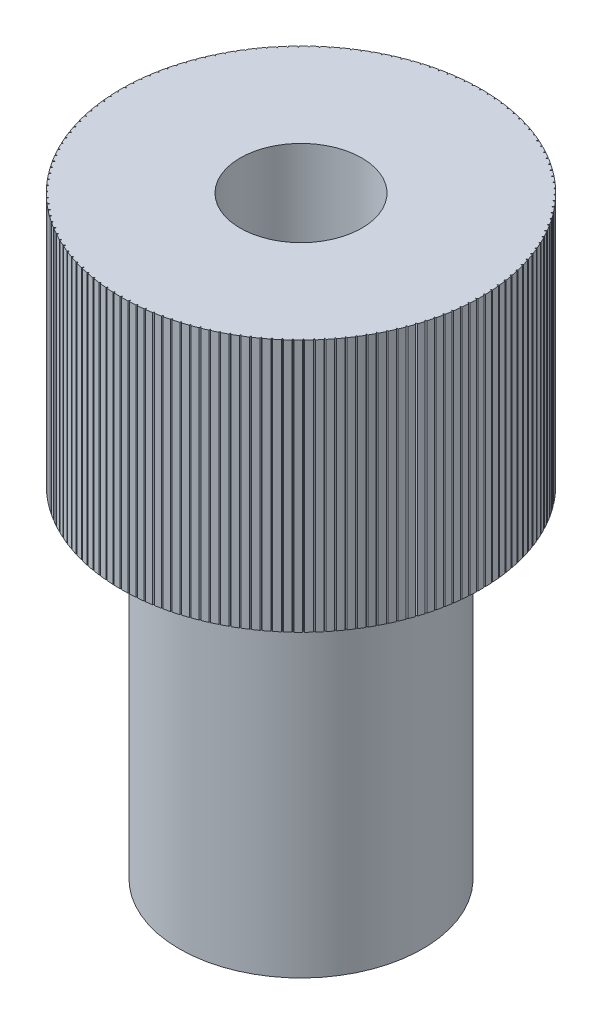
SolidWorks part; units mm, degrees
ref_plane "Front Plane" through (0, 0, 0) normal (0, 0, 1) x (1, 0, 0)
ref_plane "Top Plane" through (0, 0, 0) normal (0, 1, 0) x (1, 0, 0)
ref_plane "Right Plane" through (0, 0, 0) normal (1, 0, 0) x (0, 0, -1)
sketch "Sketch1" plane through (0, 0, 0) normal (1, 0, 0) x (0, 0, -1)
  line L0 (4.699, 8.89) -> (3.175, 8.89)
  line L1 (0, 0) -> (3.175, 0)
  line L2 (0, 0) -> (0, 15.494)
  line L3 (0, 15.494) -> (4.699, 15.494)
  line L4 (4.699, 8.89) -> (4.699, 15.494)
  line L5 (3.175, 8.89) -> (3.175, 0)
  line L6 (0, 0) -> (0, 37.8696) construction
  dimension "D1" = 4.699
  dimension "D2" = 3.175
  dimension "D3" = 8.89
  dimension "D4" = 15.494
revolve "Revolve1" add sketch "Sketch1" angle 360 about L6
sketch "Sketch2" plane through (0, 15.494, 0) normal (0, 1, 0) x (1, 0, 0)
  line L0 (0, 4.654) -> (0, 5.0784) construction
  line L1 (0.0182, 4.699) -> (0, 4.654)
  line L2 (-0.0182, 4.699) -> (0, 4.654)
  line L3 (0.2149, 4.6941) -> (0.1949, 4.6499)
  line L4 (0.1786, 4.6956) -> (0.1949, 4.6499)
  line L5 (0.4113, 4.681) -> (0.3894, 4.6377)
  line L6 (0.3751, 4.684) -> (0.3894, 4.6377)
  line L7 (0.607, 4.6596) -> (0.5833, 4.6173)
  line L8 (0.5709, 4.6642) -> (0.5833, 4.6173)
  line L9 (0.8016, 4.6301) -> (0.7761, 4.5888)
  line L10 (0.7657, 4.6362) -> (0.7761, 4.5888)
  line L11 (0.9947, 4.5925) -> (0.9676, 4.5523)
  line L12 (0.9592, 4.6001) -> (0.9676, 4.5523)
  line L13 (1.1862, 4.5468) -> (1.1574, 4.5078)
  line L14 (1.151, 4.5559) -> (1.1574, 4.5078)
  line L15 (1.3755, 4.4932) -> (1.3452, 4.4554)
  line L16 (1.3408, 4.5037) -> (1.3452, 4.4554)
  line L17 (1.5625, 4.4316) -> (1.5305, 4.3951)
  line L18 (1.5282, 4.4436) -> (1.5305, 4.3951)
  line L19 (1.7467, 4.3623) -> (1.7133, 4.3272)
  line L20 (1.7129, 4.3757) -> (1.7133, 4.3272)
  line L21 (1.9278, 4.2853) -> (1.893, 4.2517)
  line L22 (1.8946, 4.3001) -> (1.893, 4.2517)
  line L23 (2.1056, 4.2008) -> (2.0693, 4.1687)
  line L24 (2.073, 4.217) -> (2.0693, 4.1687)
  line L25 (2.2797, 4.109) -> (2.2421, 4.0783)
  line L26 (2.2478, 4.1265) -> (2.2421, 4.0783)
  line L27 (2.4497, 4.0099) -> (2.4109, 3.9809)
  line L28 (2.4186, 4.0287) -> (2.4109, 3.9809)
  line L29 (2.6155, 3.9038) -> (2.5755, 3.8764)
  line L30 (2.5852, 3.9239) -> (2.5755, 3.8764)
  line L31 (2.7767, 3.7909) -> (2.7356, 3.7652)
  line L32 (2.7473, 3.8122) -> (2.7356, 3.7652)
  line L33 (2.933, 3.6713) -> (2.8908, 3.6473)
  line L34 (2.9045, 3.6938) -> (2.8908, 3.6473)
  line L35 (3.0842, 3.5452) -> (3.041, 3.5231)
  line L36 (3.0566, 3.569) -> (3.041, 3.5231)
  line L37 (3.2299, 3.413) -> (3.1859, 3.3926)
  line L38 (3.2034, 3.4378) -> (3.1859, 3.3926)
  line L39 (3.37, 3.2747) -> (3.3252, 3.2562)
  line L40 (3.3446, 3.3007) -> (3.3252, 3.2562)
  line L41 (3.5042, 3.1307) -> (3.4586, 3.1141)
  line L42 (3.4799, 3.1577) -> (3.4586, 3.1141)
  line L43 (3.6322, 2.9812) -> (3.586, 2.9666)
  line L44 (3.609, 3.0092) -> (3.586, 2.9666)
  line L45 (3.7539, 2.8265) -> (3.7071, 2.8138)
  line L46 (3.7319, 2.8555) -> (3.7071, 2.8138)
  line L47 (3.8689, 2.6668) -> (3.8216, 2.6561)
  line L48 (3.8482, 2.6967) -> (3.8216, 2.6561)
  line L49 (3.9772, 2.5025) -> (3.9295, 2.4937)
  line L50 (3.9577, 2.5332) -> (3.9295, 2.4937)
  line L51 (4.0785, 2.3337) -> (4.0305, 2.327)
  line L52 (4.0603, 2.3652) -> (4.0305, 2.327)
  line L53 (4.1727, 2.1609) -> (4.1244, 2.1562)
  line L54 (4.1558, 2.1931) -> (4.1244, 2.1562)
  line L55 (4.2595, 1.9843) -> (4.2111, 1.9816)
  line L56 (4.244, 2.0172) -> (4.2111, 1.9816)
  line L57 (4.3388, 1.8042) -> (4.2904, 1.8035)
  line L58 (4.3248, 1.8377) -> (4.2904, 1.8035)
  line L59 (4.4106, 1.6209) -> (4.3621, 1.6223)
  line L60 (4.3979, 1.655) -> (4.3621, 1.6223)
  line L61 (4.4746, 1.4348) -> (4.4262, 1.4382)
  line L62 (4.4634, 1.4693) -> (4.4262, 1.4382)
  line L63 (4.5308, 1.2461) -> (4.4826, 1.2516)
  line L64 (4.521, 1.2811) -> (4.4826, 1.2516)
  line L65 (4.579, 1.0553) -> (4.531, 1.0627)
  line L66 (4.5707, 1.0907) -> (4.531, 1.0627)
  line L67 (4.6191, 0.8626) -> (4.5716, 0.8721)
  line L68 (4.6123, 0.8983) -> (4.5716, 0.8721)
  line L69 (4.6512, 0.6685) -> (4.6041, 0.6799)
  line L70 (4.6459, 0.7044) -> (4.6041, 0.6799)
  line L71 (4.6751, 0.4731) -> (4.6285, 0.4865)
  line L72 (4.6713, 0.5092) -> (4.6285, 0.4865)
  line L73 (4.6908, 0.2769) -> (4.6448, 0.2922)
  line L74 (4.6886, 0.3132) -> (4.6448, 0.2922)
  line L75 (4.6983, 0.0802) -> (4.653, 0.0975)
  line L76 (4.6976, 0.1166) -> (4.653, 0.0975)
  line L77 (4.6976, -0.1166) -> (4.653, -0.0975)
  line L78 (4.6983, -0.0802) -> (4.653, -0.0975)
  line L79 (4.6886, -0.3132) -> (4.6448, -0.2922)
  line L80 (4.6908, -0.2769) -> (4.6448, -0.2922)
  line L81 (4.6713, -0.5092) -> (4.6285, -0.4865)
  line L82 (4.6751, -0.4731) -> (4.6285, -0.4865)
  line L83 (4.6459, -0.7044) -> (4.6041, -0.6799)
  line L84 (4.6512, -0.6685) -> (4.6041, -0.6799)
  line L85 (4.6123, -0.8983) -> (4.5716, -0.8721)
  line L86 (4.6191, -0.8626) -> (4.5716, -0.8721)
  line L87 (4.5707, -1.0907) -> (4.531, -1.0627)
  line L88 (4.579, -1.0553) -> (4.531, -1.0627)
  line L89 (4.521, -1.2811) -> (4.4826, -1.2516)
  line L90 (4.5308, -1.2461) -> (4.4826, -1.2516)
  line L91 (4.4634, -1.4693) -> (4.4262, -1.4382)
  line L92 (4.4746, -1.4348) -> (4.4262, -1.4382)
  line L93 (4.3979, -1.655) -> (4.3621, -1.6223)
  line L94 (4.4106, -1.6209) -> (4.3621, -1.6223)
  line L95 (4.3248, -1.8377) -> (4.2904, -1.8035)
  line L96 (4.3388, -1.8042) -> (4.2904, -1.8035)
  line L97 (4.244, -2.0172) -> (4.2111, -1.9816)
  line L98 (4.2595, -1.9843) -> (4.2111, -1.9816)
  line L99 (4.1558, -2.1931) -> (4.1244, -2.1562)
  line L100 (4.1727, -2.1609) -> (4.1244, -2.1562)
  line L101 (4.0603, -2.3652) -> (4.0305, -2.327)
  line L102 (4.0785, -2.3337) -> (4.0305, -2.327)
  line L103 (3.9577, -2.5332) -> (3.9295, -2.4937)
  line L104 (3.9772, -2.5025) -> (3.9295, -2.4937)
  line L105 (3.8482, -2.6967) -> (3.8216, -2.6561)
  line L106 (3.8689, -2.6668) -> (3.8216, -2.6561)
  line L107 (3.7319, -2.8555) -> (3.7071, -2.8138)
  line L108 (3.7539, -2.8265) -> (3.7071, -2.8138)
  line L109 (3.609, -3.0092) -> (3.586, -2.9666)
  line L110 (3.6322, -2.9812) -> (3.586, -2.9666)
  line L111 (3.4799, -3.1577) -> (3.4586, -3.1141)
  line L112 (3.5042, -3.1307) -> (3.4586, -3.1141)
  line L113 (3.3446, -3.3007) -> (3.3252, -3.2562)
  line L114 (3.37, -3.2747) -> (3.3252, -3.2562)
  line L115 (3.2034, -3.4378) -> (3.1859, -3.3926)
  line L116 (3.2299, -3.413) -> (3.1859, -3.3926)
  line L117 (3.0566, -3.569) -> (3.041, -3.5231)
  line L118 (3.0842, -3.5452) -> (3.041, -3.5231)
  line L119 (2.9045, -3.6938) -> (2.8908, -3.6473)
  line L120 (2.933, -3.6713) -> (2.8908, -3.6473)
  line L121 (2.7473, -3.8122) -> (2.7356, -3.7652)
  line L122 (2.7767, -3.7909) -> (2.7356, -3.7652)
  line L123 (2.5852, -3.9239) -> (2.5755, -3.8764)
  line L124 (2.6155, -3.9038) -> (2.5755, -3.8764)
  line L125 (2.4186, -4.0287) -> (2.4109, -3.9809)
  line L126 (2.4497, -4.0099) -> (2.4109, -3.9809)
  line L127 (2.2478, -4.1265) -> (2.2421, -4.0783)
  line L128 (2.2797, -4.109) -> (2.2421, -4.0783)
  line L129 (2.073, -4.217) -> (2.0693, -4.1687)
  line L130 (2.1056, -4.2008) -> (2.0693, -4.1687)
  line L131 (1.8946, -4.3001) -> (1.893, -4.2517)
  line L132 (1.9278, -4.2853) -> (1.893, -4.2517)
  line L133 (1.7129, -4.3757) -> (1.7133, -4.3272)
  line L134 (1.7467, -4.3623) -> (1.7133, -4.3272)
  line L135 (1.5282, -4.4436) -> (1.5305, -4.3951)
  line L136 (1.5625, -4.4316) -> (1.5305, -4.3951)
  line L137 (1.3408, -4.5037) -> (1.3452, -4.4554)
  line L138 (1.3755, -4.4932) -> (1.3452, -4.4554)
  line L139 (1.151, -4.5559) -> (1.1574, -4.5078)
  line L140 (1.1862, -4.5468) -> (1.1574, -4.5078)
  line L141 (0.9592, -4.6001) -> (0.9676, -4.5523)
  line L142 (0.9947, -4.5925) -> (0.9676, -4.5523)
  line L143 (0.7657, -4.6362) -> (0.7761, -4.5888)
  line L144 (0.8016, -4.6301) -> (0.7761, -4.5888)
  line L145 (0.5709, -4.6642) -> (0.5833, -4.6173)
  line L146 (0.607, -4.6596) -> (0.5833, -4.6173)
  line L147 (0.3751, -4.684) -> (0.3894, -4.6377)
  line L148 (0.4113, -4.681) -> (0.3894, -4.6377)
  line L149 (0.1786, -4.6956) -> (0.1949, -4.6499)
  line L150 (0.2149, -4.6941) -> (0.1949, -4.6499)
  line L151 (-0.0182, -4.699) -> (0, -4.654)
  line L152 (0.0182, -4.699) -> (0, -4.654)
  line L153 (-0.2149, -4.6941) -> (-0.1949, -4.6499)
  line L154 (-0.1786, -4.6956) -> (-0.1949, -4.6499)
  line L155 (-0.4113, -4.681) -> (-0.3894, -4.6377)
  line L156 (-0.3751, -4.684) -> (-0.3894, -4.6377)
  line L157 (-0.607, -4.6596) -> (-0.5833, -4.6173)
  line L158 (-0.5709, -4.6642) -> (-0.5833, -4.6173)
  line L159 (-0.8016, -4.6301) -> (-0.7761, -4.5888)
  line L160 (-0.7657, -4.6362) -> (-0.7761, -4.5888)
  line L161 (-0.9947, -4.5925) -> (-0.9676, -4.5523)
  line L162 (-0.9592, -4.6001) -> (-0.9676, -4.5523)
  line L163 (-1.1862, -4.5468) -> (-1.1574, -4.5078)
  line L164 (-1.151, -4.5559) -> (-1.1574, -4.5078)
  line L165 (-1.3755, -4.4932) -> (-1.3452, -4.4554)
  line L166 (-1.3408, -4.5037) -> (-1.3452, -4.4554)
  line L167 (-1.5625, -4.4316) -> (-1.5305, -4.3951)
  line L168 (-1.5282, -4.4436) -> (-1.5305, -4.3951)
  line L169 (-1.7467, -4.3623) -> (-1.7133, -4.3272)
  line L170 (-1.7129, -4.3757) -> (-1.7133, -4.3272)
  line L171 (-1.9278, -4.2853) -> (-1.893, -4.2517)
  line L172 (-1.8946, -4.3001) -> (-1.893, -4.2517)
  line L173 (-2.1056, -4.2008) -> (-2.0693, -4.1687)
  line L174 (-2.073, -4.217) -> (-2.0693, -4.1687)
  line L175 (-2.2797, -4.109) -> (-2.2421, -4.0783)
  line L176 (-2.2478, -4.1265) -> (-2.2421, -4.0783)
  line L177 (-2.4497, -4.0099) -> (-2.4109, -3.9809)
  line L178 (-2.4186, -4.0287) -> (-2.4109, -3.9809)
  line L179 (-2.6155, -3.9038) -> (-2.5755, -3.8764)
  line L180 (-2.5852, -3.9239) -> (-2.5755, -3.8764)
  line L181 (-2.7767, -3.7909) -> (-2.7356, -3.7652)
  line L182 (-2.7473, -3.8122) -> (-2.7356, -3.7652)
  line L183 (-2.933, -3.6713) -> (-2.8908, -3.6473)
  line L184 (-2.9045, -3.6938) -> (-2.8908, -3.6473)
  line L185 (-3.0842, -3.5452) -> (-3.041, -3.5231)
  line L186 (-3.0566, -3.569) -> (-3.041, -3.5231)
  line L187 (-3.2299, -3.413) -> (-3.1859, -3.3926)
  line L188 (-3.2034, -3.4378) -> (-3.1859, -3.3926)
  line L189 (-3.37, -3.2747) -> (-3.3252, -3.2562)
  line L190 (-3.3446, -3.3007) -> (-3.3252, -3.2562)
  line L191 (-3.5042, -3.1307) -> (-3.4586, -3.1141)
  line L192 (-3.4799, -3.1577) -> (-3.4586, -3.1141)
  line L193 (-3.6322, -2.9812) -> (-3.586, -2.9666)
  line L194 (-3.609, -3.0092) -> (-3.586, -2.9666)
  line L195 (-3.7539, -2.8265) -> (-3.7071, -2.8138)
  line L196 (-3.7319, -2.8555) -> (-3.7071, -2.8138)
  line L197 (-3.8689, -2.6668) -> (-3.8216, -2.6561)
  line L198 (-3.8482, -2.6967) -> (-3.8216, -2.6561)
  line L199 (-3.9772, -2.5025) -> (-3.9295, -2.4937)
  line L200 (-3.9577, -2.5332) -> (-3.9295, -2.4937)
  line L201 (-4.0785, -2.3337) -> (-4.0305, -2.327)
  line L202 (-4.0603, -2.3652) -> (-4.0305, -2.327)
  line L203 (-4.1727, -2.1609) -> (-4.1244, -2.1562)
  line L204 (-4.1558, -2.1931) -> (-4.1244, -2.1562)
  line L205 (-4.2595, -1.9843) -> (-4.2111, -1.9816)
  line L206 (-4.244, -2.0172) -> (-4.2111, -1.9816)
  line L207 (-4.3388, -1.8042) -> (-4.2904, -1.8035)
  line L208 (-4.3248, -1.8377) -> (-4.2904, -1.8035)
  line L209 (-4.4106, -1.6209) -> (-4.3621, -1.6223)
  line L210 (-4.3979, -1.655) -> (-4.3621, -1.6223)
  line L211 (-4.4746, -1.4348) -> (-4.4262, -1.4382)
  line L212 (-4.4634, -1.4693) -> (-4.4262, -1.4382)
  line L213 (-4.5308, -1.2461) -> (-4.4826, -1.2516)
  line L214 (-4.521, -1.2811) -> (-4.4826, -1.2516)
  line L215 (-4.579, -1.0553) -> (-4.531, -1.0627)
  line L216 (-4.5707, -1.0907) -> (-4.531, -1.0627)
  line L217 (-4.6191, -0.8626) -> (-4.5716, -0.8721)
  line L218 (-4.6123, -0.8983) -> (-4.5716, -0.8721)
  line L219 (-4.6512, -0.6685) -> (-4.6041, -0.6799)
  line L220 (-4.6459, -0.7044) -> (-4.6041, -0.6799)
  line L221 (-4.6751, -0.4731) -> (-4.6285, -0.4865)
  line L222 (-4.6713, -0.5092) -> (-4.6285, -0.4865)
  line L223 (-4.6908, -0.2769) -> (-4.6448, -0.2922)
  line L224 (-4.6886, -0.3132) -> (-4.6448, -0.2922)
  line L225 (-4.6983, -0.0802) -> (-4.653, -0.0975)
  line L226 (-4.6976, -0.1166) -> (-4.653, -0.0975)
  line L227 (-4.6976, 0.1166) -> (-4.653, 0.0975)
  line L228 (-4.6983, 0.0802) -> (-4.653, 0.0975)
  line L229 (-4.6886, 0.3132) -> (-4.6448, 0.2922)
  line L230 (-4.6908, 0.2769) -> (-4.6448, 0.2922)
  line L231 (-4.6713, 0.5092) -> (-4.6285, 0.4865)
  line L232 (-4.6751, 0.4731) -> (-4.6285, 0.4865)
  line L233 (-4.6459, 0.7044) -> (-4.6041, 0.6799)
  line L234 (-4.6512, 0.6685) -> (-4.6041, 0.6799)
  line L235 (-4.6123, 0.8983) -> (-4.5716, 0.8721)
  line L236 (-4.6191, 0.8626) -> (-4.5716, 0.8721)
  line L237 (-4.5707, 1.0907) -> (-4.531, 1.0627)
  line L238 (-4.579, 1.0553) -> (-4.531, 1.0627)
  line L239 (-4.521, 1.2811) -> (-4.4826, 1.2516)
  line L240 (-4.5308, 1.2461) -> (-4.4826, 1.2516)
  line L241 (-4.4634, 1.4693) -> (-4.4262, 1.4382)
  line L242 (-4.4746, 1.4348) -> (-4.4262, 1.4382)
  line L243 (-4.3979, 1.655) -> (-4.3621, 1.6223)
  line L244 (-4.4106, 1.6209) -> (-4.3621, 1.6223)
  line L245 (-4.3248, 1.8377) -> (-4.2904, 1.8035)
  line L246 (-4.3388, 1.8042) -> (-4.2904, 1.8035)
  line L247 (-4.244, 2.0172) -> (-4.2111, 1.9816)
  line L248 (-4.2595, 1.9843) -> (-4.2111, 1.9816)
  line L249 (-4.1558, 2.1931) -> (-4.1244, 2.1562)
  line L250 (-4.1727, 2.1609) -> (-4.1244, 2.1562)
  line L251 (-4.0603, 2.3652) -> (-4.0305, 2.327)
  line L252 (-4.0785, 2.3337) -> (-4.0305, 2.327)
  line L253 (-3.9577, 2.5332) -> (-3.9295, 2.4937)
  line L254 (-3.9772, 2.5025) -> (-3.9295, 2.4937)
  line L255 (-3.8482, 2.6967) -> (-3.8216, 2.6561)
  line L256 (-3.8689, 2.6668) -> (-3.8216, 2.6561)
  line L257 (-3.7319, 2.8555) -> (-3.7071, 2.8138)
  line L258 (-3.7539, 2.8265) -> (-3.7071, 2.8138)
  line L259 (-3.609, 3.0092) -> (-3.586, 2.9666)
  line L260 (-3.6322, 2.9812) -> (-3.586, 2.9666)
  line L261 (-3.4799, 3.1577) -> (-3.4586, 3.1141)
  line L262 (-3.5042, 3.1307) -> (-3.4586, 3.1141)
  line L263 (-3.3446, 3.3007) -> (-3.3252, 3.2562)
  line L264 (-3.37, 3.2747) -> (-3.3252, 3.2562)
  line L265 (-3.2034, 3.4378) -> (-3.1859, 3.3926)
  line L266 (-3.2299, 3.413) -> (-3.1859, 3.3926)
  line L267 (-3.0566, 3.569) -> (-3.041, 3.5231)
  line L268 (-3.0842, 3.5452) -> (-3.041, 3.5231)
  line L269 (-2.9045, 3.6938) -> (-2.8908, 3.6473)
  line L270 (-2.933, 3.6713) -> (-2.8908, 3.6473)
  line L271 (-2.7473, 3.8122) -> (-2.7356, 3.7652)
  line L272 (-2.7767, 3.7909) -> (-2.7356, 3.7652)
  line L273 (-2.5852, 3.9239) -> (-2.5755, 3.8764)
  line L274 (-2.6155, 3.9038) -> (-2.5755, 3.8764)
  line L275 (-2.4186, 4.0287) -> (-2.4109, 3.9809)
  line L276 (-2.4497, 4.0099) -> (-2.4109, 3.9809)
  line L277 (-2.2478, 4.1265) -> (-2.2421, 4.0783)
  line L278 (-2.2797, 4.109) -> (-2.2421, 4.0783)
  line L279 (-2.073, 4.217) -> (-2.0693, 4.1687)
  line L280 (-2.1056, 4.2008) -> (-2.0693, 4.1687)
  line L281 (-1.8946, 4.3001) -> (-1.893, 4.2517)
  line L282 (-1.9278, 4.2853) -> (-1.893, 4.2517)
  line L283 (-1.7129, 4.3757) -> (-1.7133, 4.3272)
  line L284 (-1.7467, 4.3623) -> (-1.7133, 4.3272)
  line L285 (-1.5282, 4.4436) -> (-1.5305, 4.3951)
  line L286 (-1.5625, 4.4316) -> (-1.5305, 4.3951)
  line L287 (-1.3408, 4.5037) -> (-1.3452, 4.4554)
  line L288 (-1.3755, 4.4932) -> (-1.3452, 4.4554)
  line L289 (-1.151, 4.5559) -> (-1.1574, 4.5078)
  line L290 (-1.1862, 4.5468) -> (-1.1574, 4.5078)
  line L291 (-0.9592, 4.6001) -> (-0.9676, 4.5523)
  line L292 (-0.9947, 4.5925) -> (-0.9676, 4.5523)
  line L293 (-0.7657, 4.6362) -> (-0.7761, 4.5888)
  line L294 (-0.8016, 4.6301) -> (-0.7761, 4.5888)
  line L295 (-0.5709, 4.6642) -> (-0.5833, 4.6173)
  line L296 (-0.607, 4.6596) -> (-0.5833, 4.6173)
  line L297 (-0.3751, 4.684) -> (-0.3894, 4.6377)
  line L298 (-0.4113, 4.681) -> (-0.3894, 4.6377)
  line L299 (-0.1786, 4.6956) -> (-0.1949, 4.6499)
  line L300 (-0.2149, 4.6941) -> (-0.1949, 4.6499)
  arc A0 (0.2149, 4.6941) -> (0.1786, 4.6956) centre (0, 0) ccw
  arc A1 (0.0182, 4.699) -> (-0.0182, 4.699) centre (0, 0) ccw
  circle A2 centre (0, 0) radius 4.699 construction
  arc A3 (0.4113, 4.681) -> (0.3751, 4.684) centre (0, 0) ccw
  arc A4 (0.607, 4.6596) -> (0.5709, 4.6642) centre (0, 0) ccw
  arc A5 (0.8016, 4.6301) -> (0.7657, 4.6362) centre (0, 0) ccw
  arc A6 (0.9947, 4.5925) -> (0.9592, 4.6001) centre (0, 0) ccw
  arc A7 (1.1862, 4.5468) -> (1.151, 4.5559) centre (0, 0) ccw
  arc A8 (1.3755, 4.4932) -> (1.3408, 4.5037) centre (0, 0) ccw
  arc A9 (1.5625, 4.4316) -> (1.5282, 4.4436) centre (0, 0) ccw
  arc A10 (1.7467, 4.3623) -> (1.7129, 4.3757) centre (0, 0) ccw
  arc A11 (1.9278, 4.2853) -> (1.8946, 4.3001) centre (0, 0) ccw
  arc A12 (2.1056, 4.2008) -> (2.073, 4.217) centre (0, 0) ccw
  arc A13 (2.2797, 4.109) -> (2.2478, 4.1265) centre (0, 0) ccw
  arc A14 (2.4497, 4.0099) -> (2.4186, 4.0287) centre (0, 0) ccw
  arc A15 (2.6155, 3.9038) -> (2.5852, 3.9239) centre (0, 0) ccw
  arc A16 (2.7767, 3.7909) -> (2.7473, 3.8122) centre (0, 0) ccw
  arc A17 (2.933, 3.6713) -> (2.9045, 3.6938) centre (0, 0) ccw
  arc A18 (3.0842, 3.5452) -> (3.0566, 3.569) centre (0, 0) ccw
  arc A19 (3.2299, 3.413) -> (3.2034, 3.4378) centre (0, 0) ccw
  arc A20 (3.37, 3.2747) -> (3.3446, 3.3007) centre (0, 0) ccw
  arc A21 (3.5042, 3.1307) -> (3.4799, 3.1577) centre (0, 0) ccw
  arc A22 (3.6322, 2.9812) -> (3.609, 3.0092) centre (0, 0) ccw
  arc A23 (3.7539, 2.8265) -> (3.7319, 2.8555) centre (0, 0) ccw
  arc A24 (3.8689, 2.6668) -> (3.8482, 2.6967) centre (0, 0) ccw
  arc A25 (3.9772, 2.5025) -> (3.9577, 2.5332) centre (0, 0) ccw
  arc A26 (4.0785, 2.3337) -> (4.0603, 2.3652) centre (0, 0) ccw
  arc A27 (4.1727, 2.1609) -> (4.1558, 2.1931) centre (0, 0) ccw
  arc A28 (4.2595, 1.9843) -> (4.244, 2.0172) centre (0, 0) ccw
  arc A29 (4.3388, 1.8042) -> (4.3248, 1.8377) centre (0, 0) ccw
  arc A30 (4.4106, 1.6209) -> (4.3979, 1.655) centre (0, 0) ccw
  arc A31 (4.4746, 1.4348) -> (4.4634, 1.4693) centre (0, 0) ccw
  arc A32 (4.5308, 1.2461) -> (4.521, 1.2811) centre (0, 0) ccw
  arc A33 (4.579, 1.0553) -> (4.5707, 1.0907) centre (0, 0) ccw
  arc A34 (4.6191, 0.8626) -> (4.6123, 0.8983) centre (0, 0) ccw
  arc A35 (4.6512, 0.6685) -> (4.6459, 0.7044) centre (0, 0) ccw
  arc A36 (4.6751, 0.4731) -> (4.6713, 0.5092) centre (0, 0) ccw
  arc A37 (4.6908, 0.2769) -> (4.6886, 0.3132) centre (0, 0) ccw
  arc A38 (4.6983, 0.0802) -> (4.6976, 0.1166) centre (0, 0) ccw
  arc A39 (4.6976, -0.1166) -> (4.6983, -0.0802) centre (0, 0) ccw
  arc A40 (4.6886, -0.3132) -> (4.6908, -0.2769) centre (0, 0) ccw
  arc A41 (4.6713, -0.5092) -> (4.6751, -0.4731) centre (0, 0) ccw
  arc A42 (4.6459, -0.7044) -> (4.6512, -0.6685) centre (0, 0) ccw
  arc A43 (4.6123, -0.8983) -> (4.6191, -0.8626) centre (0, 0) ccw
  arc A44 (4.5707, -1.0907) -> (4.579, -1.0553) centre (0, 0) ccw
  arc A45 (4.521, -1.2811) -> (4.5308, -1.2461) centre (0, 0) ccw
  arc A46 (4.4634, -1.4693) -> (4.4746, -1.4348) centre (0, 0) ccw
  arc A47 (4.3979, -1.655) -> (4.4106, -1.6209) centre (0, 0) ccw
  arc A48 (4.3248, -1.8377) -> (4.3388, -1.8042) centre (0, 0) ccw
  arc A49 (4.244, -2.0172) -> (4.2595, -1.9843) centre (0, 0) ccw
  arc A50 (4.1558, -2.1931) -> (4.1727, -2.1609) centre (0, 0) ccw
  arc A51 (4.0603, -2.3652) -> (4.0785, -2.3337) centre (0, 0) ccw
  arc A52 (3.9577, -2.5332) -> (3.9772, -2.5025) centre (0, 0) ccw
  arc A53 (3.8482, -2.6967) -> (3.8689, -2.6668) centre (0, 0) ccw
  arc A54 (3.7319, -2.8555) -> (3.7539, -2.8265) centre (0, 0) ccw
  arc A55 (3.609, -3.0092) -> (3.6322, -2.9812) centre (0, 0) ccw
  arc A56 (3.4799, -3.1577) -> (3.5042, -3.1307) centre (0, 0) ccw
  arc A57 (3.3446, -3.3007) -> (3.37, -3.2747) centre (0, 0) ccw
  arc A58 (3.2034, -3.4378) -> (3.2299, -3.413) centre (0, 0) ccw
  arc A59 (3.0566, -3.569) -> (3.0842, -3.5452) centre (0, 0) ccw
  arc A60 (2.9045, -3.6938) -> (2.933, -3.6713) centre (0, 0) ccw
  arc A61 (2.7473, -3.8122) -> (2.7767, -3.7909) centre (0, 0) ccw
  arc A62 (2.5852, -3.9239) -> (2.6155, -3.9038) centre (0, 0) ccw
  arc A63 (2.4186, -4.0287) -> (2.4497, -4.0099) centre (0, 0) ccw
  arc A64 (2.2478, -4.1265) -> (2.2797, -4.109) centre (0, 0) ccw
  arc A65 (2.073, -4.217) -> (2.1056, -4.2008) centre (0, 0) ccw
  arc A66 (1.8946, -4.3001) -> (1.9278, -4.2853) centre (0, 0) ccw
  arc A67 (1.7129, -4.3757) -> (1.7467, -4.3623) centre (0, 0) ccw
  arc A68 (1.5282, -4.4436) -> (1.5625, -4.4316) centre (0, 0) ccw
  arc A69 (1.3408, -4.5037) -> (1.3755, -4.4932) centre (0, 0) ccw
  arc A70 (1.151, -4.5559) -> (1.1862, -4.5468) centre (0, 0) ccw
  arc A71 (0.9592, -4.6001) -> (0.9947, -4.5925) centre (0, 0) ccw
  arc A72 (0.7657, -4.6362) -> (0.8016, -4.6301) centre (0, 0) ccw
  arc A73 (0.5709, -4.6642) -> (0.607, -4.6596) centre (0, 0) ccw
  arc A74 (0.3751, -4.684) -> (0.4113, -4.681) centre (0, 0) ccw
  arc A75 (0.1786, -4.6956) -> (0.2149, -4.6941) centre (0, 0) ccw
  arc A76 (-0.0182, -4.699) -> (0.0182, -4.699) centre (0, 0) ccw
  arc A77 (-0.2149, -4.6941) -> (-0.1786, -4.6956) centre (0, 0) ccw
  arc A78 (-0.4113, -4.681) -> (-0.3751, -4.684) centre (0, 0) ccw
  arc A79 (-0.607, -4.6596) -> (-0.5709, -4.6642) centre (0, 0) ccw
  arc A80 (-0.8016, -4.6301) -> (-0.7657, -4.6362) centre (0, 0) ccw
  arc A81 (-0.9947, -4.5925) -> (-0.9592, -4.6001) centre (0, 0) ccw
  arc A82 (-1.1862, -4.5468) -> (-1.151, -4.5559) centre (0, 0) ccw
  arc A83 (-1.3755, -4.4932) -> (-1.3408, -4.5037) centre (0, 0) ccw
  arc A84 (-1.5625, -4.4316) -> (-1.5282, -4.4436) centre (0, 0) ccw
  arc A85 (-1.7467, -4.3623) -> (-1.7129, -4.3757) centre (0, 0) ccw
  arc A86 (-1.9278, -4.2853) -> (-1.8946, -4.3001) centre (0, 0) ccw
  arc A87 (-2.1056, -4.2008) -> (-2.073, -4.217) centre (0, 0) ccw
  arc A88 (-2.2797, -4.109) -> (-2.2478, -4.1265) centre (0, 0) ccw
  arc A89 (-2.4497, -4.0099) -> (-2.4186, -4.0287) centre (0, 0) ccw
  arc A90 (-2.6155, -3.9038) -> (-2.5852, -3.9239) centre (0, 0) ccw
  arc A91 (-2.7767, -3.7909) -> (-2.7473, -3.8122) centre (0, 0) ccw
  arc A92 (-2.933, -3.6713) -> (-2.9045, -3.6938) centre (0, 0) ccw
  arc A93 (-3.0842, -3.5452) -> (-3.0566, -3.569) centre (0, 0) ccw
  arc A94 (-3.2299, -3.413) -> (-3.2034, -3.4378) centre (0, 0) ccw
  arc A95 (-3.37, -3.2747) -> (-3.3446, -3.3007) centre (0, 0) ccw
  arc A96 (-3.5042, -3.1307) -> (-3.4799, -3.1577) centre (0, 0) ccw
  arc A97 (-3.6322, -2.9812) -> (-3.609, -3.0092) centre (0, 0) ccw
  arc A98 (-3.7539, -2.8265) -> (-3.7319, -2.8555) centre (0, 0) ccw
  arc A99 (-3.8689, -2.6668) -> (-3.8482, -2.6967) centre (0, 0) ccw
  arc A100 (-3.9772, -2.5025) -> (-3.9577, -2.5332) centre (0, 0) ccw
  arc A101 (-4.0785, -2.3337) -> (-4.0603, -2.3652) centre (0, 0) ccw
  arc A102 (-4.1727, -2.1609) -> (-4.1558, -2.1931) centre (0, 0) ccw
  arc A103 (-4.2595, -1.9843) -> (-4.244, -2.0172) centre (0, 0) ccw
  arc A104 (-4.3388, -1.8042) -> (-4.3248, -1.8377) centre (0, 0) ccw
  arc A105 (-4.4106, -1.6209) -> (-4.3979, -1.655) centre (0, 0) ccw
  arc A106 (-4.4746, -1.4348) -> (-4.4634, -1.4693) centre (0, 0) ccw
  arc A107 (-4.5308, -1.2461) -> (-4.521, -1.2811) centre (0, 0) ccw
  arc A108 (-4.579, -1.0553) -> (-4.5707, -1.0907) centre (0, 0) ccw
  arc A109 (-4.6191, -0.8626) -> (-4.6123, -0.8983) centre (0, 0) ccw
  arc A110 (-4.6512, -0.6685) -> (-4.6459, -0.7044) centre (0, 0) ccw
  arc A111 (-4.6751, -0.4731) -> (-4.6713, -0.5092) centre (0, 0) ccw
  arc A112 (-4.6908, -0.2769) -> (-4.6886, -0.3132) centre (0, 0) ccw
  arc A113 (-4.6983, -0.0802) -> (-4.6976, -0.1166) centre (0, 0) ccw
  arc A114 (-4.6976, 0.1166) -> (-4.6983, 0.0802) centre (0, 0) ccw
  arc A115 (-4.6886, 0.3132) -> (-4.6908, 0.2769) centre (0, 0) ccw
  arc A116 (-4.6713, 0.5092) -> (-4.6751, 0.4731) centre (0, 0) ccw
  arc A117 (-4.6459, 0.7044) -> (-4.6512, 0.6685) centre (0, 0) ccw
  arc A118 (-4.6123, 0.8983) -> (-4.6191, 0.8626) centre (0, 0) ccw
  arc A119 (-4.5707, 1.0907) -> (-4.579, 1.0553) centre (0, 0) ccw
  arc A120 (-4.521, 1.2811) -> (-4.5308, 1.2461) centre (0, 0) ccw
  arc A121 (-4.4634, 1.4693) -> (-4.4746, 1.4348) centre (0, 0) ccw
  arc A122 (-4.3979, 1.655) -> (-4.4106, 1.6209) centre (0, 0) ccw
  arc A123 (-4.3248, 1.8377) -> (-4.3388, 1.8042) centre (0, 0) ccw
  arc A124 (-4.244, 2.0172) -> (-4.2595, 1.9843) centre (0, 0) ccw
  arc A125 (-4.1558, 2.1931) -> (-4.1727, 2.1609) centre (0, 0) ccw
  arc A126 (-4.0603, 2.3652) -> (-4.0785, 2.3337) centre (0, 0) ccw
  arc A127 (-3.9577, 2.5332) -> (-3.9772, 2.5025) centre (0, 0) ccw
  arc A128 (-3.8482, 2.6967) -> (-3.8689, 2.6668) centre (0, 0) ccw
  arc A129 (-3.7319, 2.8555) -> (-3.7539, 2.8265) centre (0, 0) ccw
  arc A130 (-3.609, 3.0092) -> (-3.6322, 2.9812) centre (0, 0) ccw
  arc A131 (-3.4799, 3.1577) -> (-3.5042, 3.1307) centre (0, 0) ccw
  arc A132 (-3.3446, 3.3007) -> (-3.37, 3.2747) centre (0, 0) ccw
  arc A133 (-3.2034, 3.4378) -> (-3.2299, 3.413) centre (0, 0) ccw
  arc A134 (-3.0566, 3.569) -> (-3.0842, 3.5452) centre (0, 0) ccw
  arc A135 (-2.9045, 3.6938) -> (-2.933, 3.6713) centre (0, 0) ccw
  arc A136 (-2.7473, 3.8122) -> (-2.7767, 3.7909) centre (0, 0) ccw
  arc A137 (-2.5852, 3.9239) -> (-2.6155, 3.9038) centre (0, 0) ccw
  arc A138 (-2.4186, 4.0287) -> (-2.4497, 4.0099) centre (0, 0) ccw
  arc A139 (-2.2478, 4.1265) -> (-2.2797, 4.109) centre (0, 0) ccw
  arc A140 (-2.073, 4.217) -> (-2.1056, 4.2008) centre (0, 0) ccw
  arc A141 (-1.8946, 4.3001) -> (-1.9278, 4.2853) centre (0, 0) ccw
  arc A142 (-1.7129, 4.3757) -> (-1.7467, 4.3623) centre (0, 0) ccw
  arc A143 (-1.5282, 4.4436) -> (-1.5625, 4.4316) centre (0, 0) ccw
  arc A144 (-1.3408, 4.5037) -> (-1.3755, 4.4932) centre (0, 0) ccw
  arc A145 (-1.151, 4.5559) -> (-1.1862, 4.5468) centre (0, 0) ccw
  arc A146 (-0.9592, 4.6001) -> (-0.9947, 4.5925) centre (0, 0) ccw
  arc A147 (-0.7657, 4.6362) -> (-0.8016, 4.6301) centre (0, 0) ccw
  arc A148 (-0.5709, 4.6642) -> (-0.607, 4.6596) centre (0, 0) ccw
  arc A149 (-0.3751, 4.684) -> (-0.4113, 4.681) centre (0, 0) ccw
  arc A150 (-0.1786, 4.6956) -> (-0.2149, 4.6941) centre (0, 0) ccw
  dimension "D1" = 150
extrude "Cut-Extrude1" cut sketch "Sketch2" against normal through all
sketch "Sketch5" plane through (0, 0, 0) normal (0, -1, 0) x (1, 0, 0)
  circle A0 centre (0, 0) radius 1.5875
  dimension "D1" = 3.175
extrude "Cut-Extrude2" cut sketch "Sketch5" against normal through all
chamfer "Chamfer1" distance 0.508 angle 60 1 edges at (0, 0, -1.5875)
equation "\"Buoyancy\"=\"SW-Volume\"*(\"SW-Density\"-.037062)"
